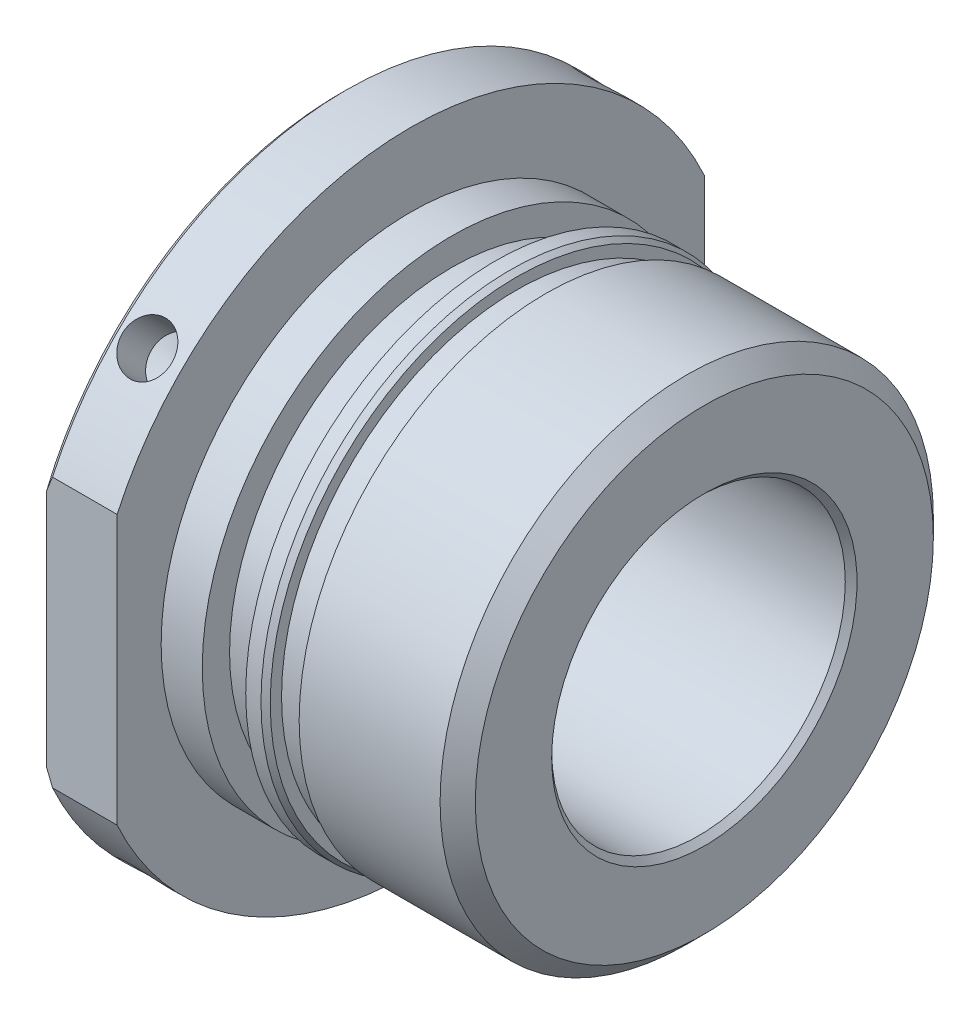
SolidWorks part; units mm, degrees
ref_plane "Plan de face" through (0, 0, 0) normal (0, 0, 1) x (1, 0, 0)
ref_plane "Plan de dessus" through (0, 0, 0) normal (0, 1, 0) x (1, 0, 0)
ref_plane "Plan de droite" through (0, 0, 0) normal (1, 0, 0) x (0, 0, -1)
sketch "Esquisse1" plane through (0, 0, 0) normal (0, 0, 1) x (1, 0, 0)
  line L0 (0, 0) -> (94.145, 0) construction
  line L3 (61, 25) -> (62, 26)
  line L5 (29, 42.5) -> (30, 41.9226)
  line L6 (12, 25) -> (12, 30)
  line L7 (0, 27.75) -> (2, 27.75)
  line L9 (7, 25) -> (12, 25)
  line L11 (2, 29) -> (7, 29)
  line L13 (7, 25) -> (7, 29)
  line L15 (23, 25) -> (61, 25)
  line L17 (12, 30) -> (23, 30)
  line L18 (23, 25) -> (23, 30)
  line L21 (62, 39) -> (59, 42)
  line L28 (30, 40) -> (35, 40)
  line L30 (35, 42) -> (59, 42)
  line L31 (35, 40) -> (35, 42)
  line L32 (30, 40) -> (30, 41.9226)
  line L33 (19, 37.85) -> (19, 42.5)
  line L34 (26.4, 37.85) -> (26.4, 42.5)
  line L35 (26.4, 42.5) -> (29, 42.5)
  line L37 (19, 37.85) -> (26.4, 37.85)
  line L40 (12, 42.5) -> (12, 55)
  line L42 (12, 42.5) -> (19, 42.5)
  line L45 (1, 55) -> (12, 55)
  line L47 (62, 26) -> (62, 39)
  line L48 (0, 54) -> (1, 55)
  line L50 (0, 27.75) -> (0, 54)
  line L51 (2, 27.75) -> (2, 29)
revolve "Révolution1" add sketch "Esquisse1" angle 360 about L0
sketch "Esquisse2" plane through (0, 0, 0) normal (-1, 0, 0) x (0, 0, 1)
  line L0 (0, -63.8593) -> (0, 57.5733) construction
  line L1 (-50, 61.2878) -> (50, 61.2878)
  line L2 (-50, 61.2878) -> (-50, -63.4599)
  line L3 (-50, -63.4599) -> (50, -63.4599)
  line L4 (50, 61.2878) -> (50, -63.4599)
  dimension "D1" = 100
extrude "Extrusion1" cut sketch "Esquisse2" against normal blind 20 flip side to cut
ref_plane "Plan1" through (0, 0, 0) normal (0, 0.7071, 0.7071) x (-1, 0, 0)
ref_plane "Plan2" through (6.5, 38.8909, -38.8909) normal (0, 0.7071, -0.7071) x (0, -0.7071, -0.7071)
sketch "Esquisse4" plane through (6.5, 38.8909, -38.8909) normal (0, 0.7071, -0.7071) x (0, -0.7071, -0.7071)
  line L1 (0, -43.1397) -> (0, 29.3638) construction
  line L2 (0, -54.5) -> (0, -16.5) construction
  line L3 (20.9331, 6.5) -> (-54, 6.5) construction
  point P4 (0, 0.5)
  dimension "D1" = 6
hole_wizard "Dégagement M81" positions "Esquisse3D1" profile "Esquisse6" hole size "M8" standard "ISO"
sketch3d "Esquisse3D1"
  point P0 (6, 38.8909, -38.8909)
  point P4 (6, 38.8909, -38.8909)
sketch "Esquisse6" plane through (6, 38.8909, -38.8909) normal (1, 0, 0) x (0, 0.7071, 0.7071)
  line L0 (0, 0) -> (0, 9.5537)
  line L1 (0, 9.5537) -> (4.25, 7)
  line L2 (4.25, 7) -> (4.25, 0)
  line L5 (4.25, 0) -> (0, 0)
  line L10 (0, 9.5537) -> (-4.25, 7) construction
  line L11 (0, -6.35) -> (0, 107.95) construction
  dimension "Diamètre du perçage" = 8.5
  dimension "Profondeur du perçage" = 7
  dimension "Angle de pointe" = 118
pattern_circular "Répétition circulaire1" count 4 over 360 about axis through (0, 0, 0) along (-1, 0, 0) of "Dégagement M81"
